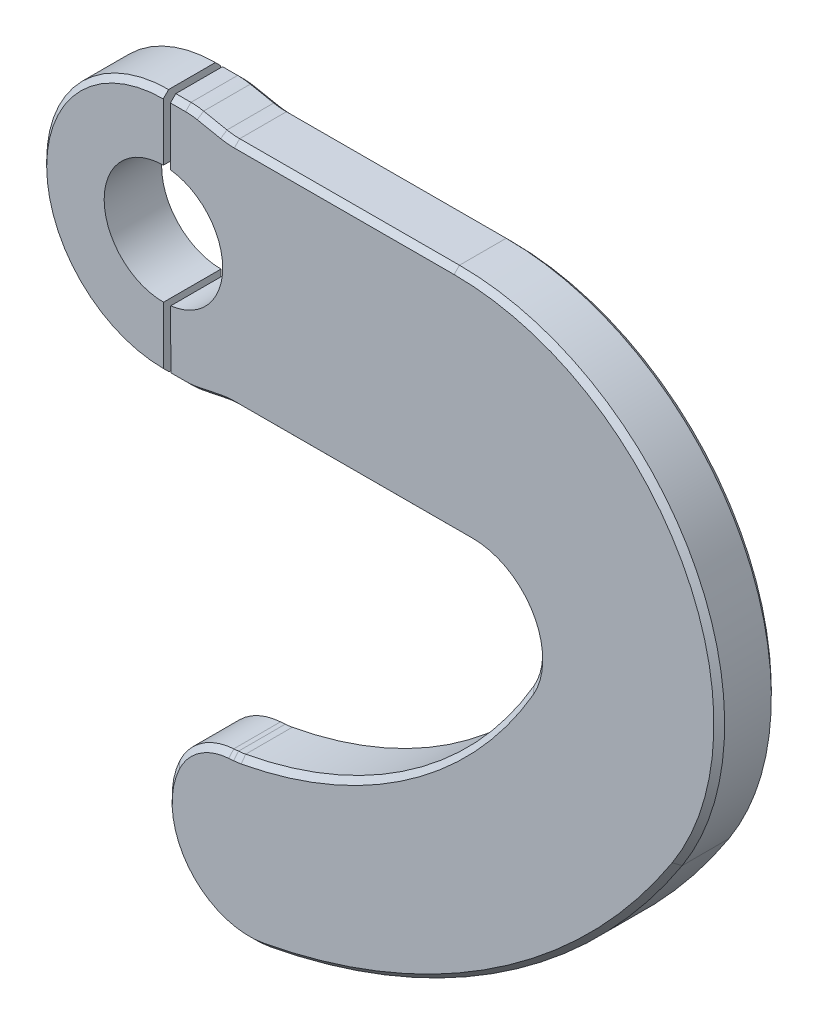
SolidWorks part; units mm, degrees
ref_plane "Front" through (0, 0, 0) normal (0, 0, 1) x (1, 0, 0)
ref_plane "Top" through (0, 0, 0) normal (0, 1, 0) x (1, 0, 0)
ref_plane "Right" through (0, 0, 0) normal (1, 0, 0) x (0, 0, -1)
imported_body "Defeature ausgeführt1"
imported_body "Defeature ausgeführt2"
other "Fläche löschen1"
other "Fläche löschen2"
